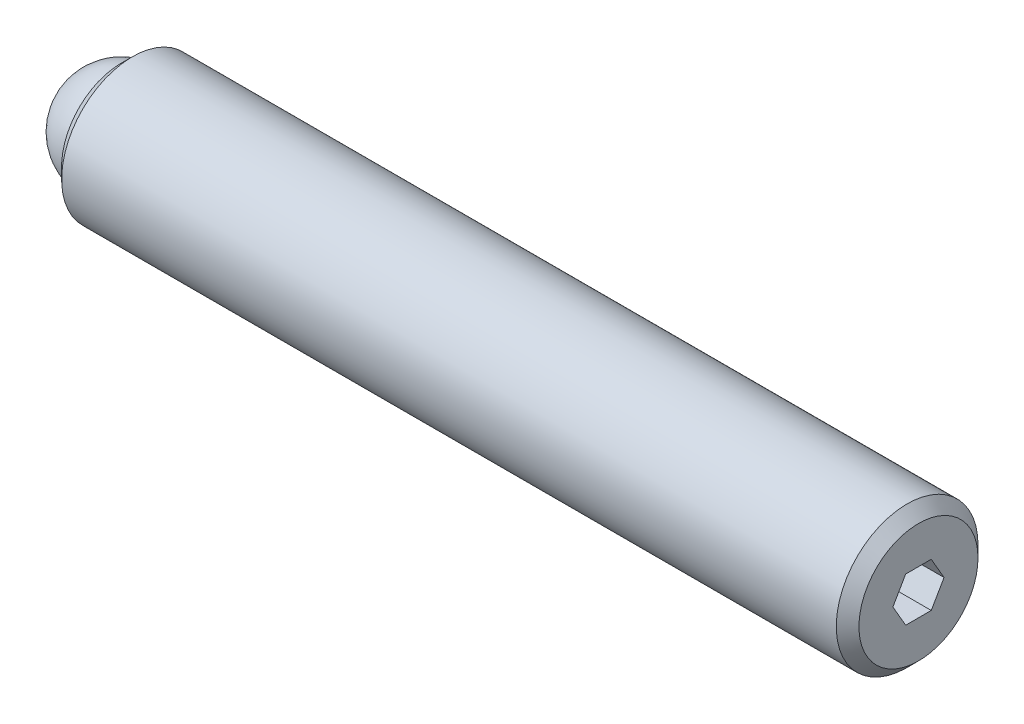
SolidWorks part; units mm, degrees
ref_plane "Front Plane" through (0, 0, 0) normal (0, 0, 1) x (1, 0, 0)
ref_plane "Top Plane" through (0, 0, 0) normal (0, 1, 0) x (1, 0, 0)
ref_plane "Right Plane" through (0, 0, 0) normal (1, 0, 0) x (0, 0, -1)
sketch "Sketch2" plane through (0, 0, 0) normal (1, 0, 0) x (0, 0, -1)
  circle A0 centre (0, 0) radius 3.175
  dimension "D1" = 6.35
extrude "Boss-Extrude1" add sketch "Sketch2" along normal blind 35.7188
sketch "Sketch3" plane through (0, 0, 0) normal (-1, 0, 0) x (0, 0, 1)
  circle A0 centre (0, 0) radius 2.3813
  dimension "D1" = 4.7625
chamfer "Chamfer1" distance 0.508 angle 45 1 edges at (0, 0, -3.175)
chamfer "Chamfer2" distance 0.508 angle 45 1 edges at (35.7188, 0, -3.175)
sketch "Sketch4" plane through (35.7188, 0, 0) normal (1, 0, 0) x (0, 0, -1)
  line L1 (1.1457, 0) -> (0.5728, 0.9922)
  line L2 (0.5728, 0.9922) -> (-0.5728, 0.9922)
  line L3 (-0.5728, 0.9922) -> (-1.1457, 0)
  line L4 (-1.1457, 0) -> (-0.5728, -0.9922)
  line L5 (-0.5728, -0.9922) -> (0.5728, -0.9922)
  line L6 (0.5728, -0.9922) -> (1.1457, 0)
  circle A0 centre (0, 0) radius 0.9922 construction
  dimension "D1" = 1.9844
extrude "Cut-Extrude2" cut sketch "Sketch4" against normal blind 2.286
extrude "Cut-Extrude3" cut sketch "Sketch3" against normal blind 2.3813
sketch "Sketch5" plane through (0, 0, 0) normal (-1, 0, 0) x (0, 0, 1)
  line L0 (0, 0) -> (0, -2.3813)
  line L1 (0, 0) -> (0, 2.3813)
  arc A0 (0, 2.3813) -> (0, -2.3813) centre (0, 0) ccw
  dimension "D1" = 2.3813
revolve "Revolve1" add sketch "Sketch5" angle 360 about L1
sketch "Sketch7" plane through (0, 0, 0) normal (-1, 0, 0) x (0, 0, 1)
  line L0 (0, 0) -> (0, 2.3813) construction
  circle A0 centre (0, 0) radius 2.3813 construction
  arc A1 (0.0635, 2.3804) -> (-0.0635, 2.3804) centre (0, 0) ccw
  arc A2 (0.0635, 2.3804) -> (-0.0635, 2.3804) centre (0, 2.3813) ccw
  dimension "D1" = 0.127
extrude "Cut-Extrude4" cut sketch "Sketch7" against normal up to surface (2.3813 mm away) contours A2 A1
